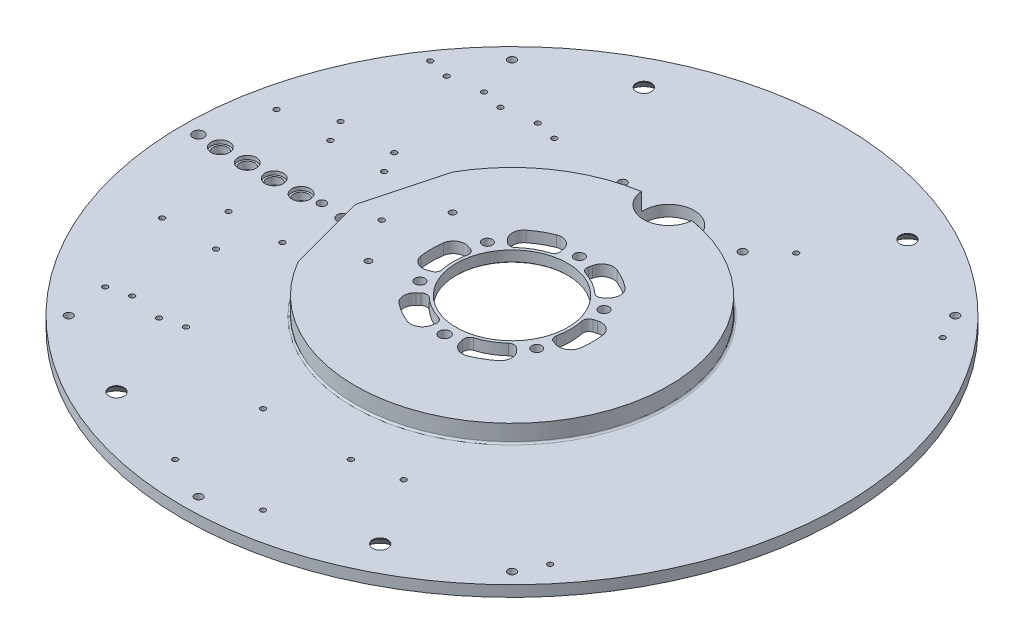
SolidWorks part; units mm, degrees
ref_plane "Front Plane" through (0, 0, 0) normal (0, 0, 1) x (1, 0, 0)
ref_plane "Top Plane" through (0, 0, 0) normal (0, 1, 0) x (1, 0, 0)
ref_plane "Right Plane" through (0, 0, 0) normal (1, 0, 0) x (0, 0, -1)
sketch "Sketch1" plane through (0, 0, 0) normal (0, 0, 1) x (1, 0, 0)
  line L0 (0, 0) -> (0, 40.0271) construction
  line L1 (-67.945, 0) -> (-142.875, 0)
  line L2 (-142.875, 0) -> (-142.875, -4.7625)
  line L3 (-61.9125, -4.7625) -> (-142.875, -4.7625)
  line L4 (-24.13, 7.62) -> (-24.13, 2.8575)
  line L5 (-67.945, 0) -> (-67.945, 7.62)
  line L6 (-67.945, 7.62) -> (-24.13, 7.62)
  line L7 (-61.9125, -4.7625) -> (-61.9125, 2.8575)
  line L8 (-61.9125, 2.8575) -> (-24.13, 2.8575)
  dimension "D1" = 285.75
  dimension "D2" = 4.7625
  dimension "D3" = 48.26
  dimension "D4" = 4.7625
  dimension "D5" = 135.89
  dimension "D6" = 123.825
  dimension "D7" = 7.62
  dimension "D8" = 12.3825
revolve "Revolve1" add sketch "Sketch1" angle 360 about L0
hole_wizard "#8-32 Tapped Hole1" positions "Sketch8" profile "Sketch7" tap size "#8-32" standard "ANSI Inch"
sketch "Sketch8" plane through (0, 0, 0) normal (0, 1, 0) x (1, 0, 0)
  line L0 (0, -135.89) -> (0, 0) construction
  point P0 (0, -135.89)
  dimension "D1" = 135.89
sketch "Sketch7" plane through (0, 0, 135.89) normal (1, 0, 0) x (0, 0, 1)
  line L0 (0, 0) -> (0, 12.446)
  line L1 (0, 12.446) -> (1.7272, 12.446)
  line L2 (1.7272, 12.446) -> (1.7272, 0)
  line L5 (1.7272, 0) -> (0, 0)
  line L10 (0, 12.446) -> (-1.7272, 12.446) construction
  line L11 (0, -6.35) -> (0, 107.95) construction
  dimension "Tap Drill Dia." = 3.4544
  dimension "Tap Drill Depth" = 12.446
  dimension "Drill Angle" = 180
pattern_circular "CirPattern1" count 8 over 360 about axis through (0, 0, 0) along (0, 1, 0) of "#8-32 Tapped Hole1"
hole_wizard "#8 Clearance Hole1" positions "Sketch10" profile "Sketch9" hole size "#8" standard "ANSI Inch"
sketch "Sketch10" plane through (0, 7.62, 0) normal (0, 1, 0) x (1, 0, 0)
  line L1 (0, 0) -> (-25.2966, 14.605) construction
  circle A0 centre (-25.2966, 14.605) radius 2.0828 construction
  point P4 (-25.2966, 14.605)
sketch "Sketch9" plane through (-25.2966, 7.62, -14.605) normal (1, 0, 0) x (0, 0, 1)
  line L0 (0, 0) -> (0, 12.3825)
  line L1 (0, 12.3825) -> (2.1526, 12.3825)
  line L2 (2.1526, 12.3825) -> (2.1526, 0)
  line L5 (2.1526, 0) -> (0, 0)
  line L11 (0, -6.35) -> (0, 107.95) construction
  dimension "Thru Hole Dia." = 4.3053
  dimension "Thru Hole Depth" = 12.3825
pattern_circular "CirPattern2" count 6 over 360 about axis through (0, 0, 0) along (0, 1, 0) of "#8 Clearance Hole1"
sketch "Sketch11" plane through (0, 2.8575, 0) normal (0, 1, 0) x (1, 0, 0)
  line L0 (0, 0) -> (-18.876, -20.5995) construction
  line L1 (-13.6339, 0) -> (0, 0) construction
  line L2 (0, 0) -> (-8.4017, -26.6469) construction
  line L3 (0, 0) -> (-25.2966, -14.605) construction
  line L4 (0, -29.21) -> (-12.7, -21.997) construction
  line L5 (-12.7, -21.997) -> (0, 0) construction
  line L6 (-12.7, -21.997) -> (-25.2966, -14.605) construction
  line L7 (0, -29.21) -> (0, 0) construction
  line L8 (-20.6687, -18.8002) -> (-21.7558, -19.789)
  line L9 (-5.9471, -27.2997) -> (-6.2598, -28.7356)
  line L10 (0, 0) -> (-93.5226, -421.8534) construction
  line L11 (0, 0) -> (-318.5744, -291.9197) construction
  arc A0 (-5.9471, -27.2997) -> (-7.6379, -24.2244) centre (-8.4017, -26.6469) ccw
  circle A1 centre (0, 0) radius 27.94 construction
  arc A2 (-17.16, -18.7268) -> (-7.6379, -24.2244) centre (0, 0) ccw
  arc A3 (-21.4589, -27.5549) -> (-13.1338, -32.3614) centre (0, 0) ccw
  arc A4 (-17.16, -18.7268) -> (-20.6687, -18.8002) centre (-18.876, -20.5995) ccw
  arc A5 (-21.4589, -27.5549) -> (-21.7558, -19.789) centre (-18.3376, -23.5469) cw
  arc A6 (-13.1338, -32.3614) -> (-6.2598, -28.7356) centre (-11.2234, -27.6543) ccw
  circle A7 centre (-93.5226, -421.8534) radius 1.5875 construction
  circle A8 centre (-318.5744, -291.9197) radius 1.5875 construction
  dimension "D3" = 34.925
  dimension "D4" = 2.54
  dimension "D2" = 25.4
  dimension "D5" = 5.08
  dimension "D6" = 3.175
  dimension "D1" = 25
extrude "Cut-Extrude2" cut sketch "Sketch11" along normal through all
pattern_circular "CirPattern3" count 6 over 360 about axis through (0, 0, 0) along (0, 1, 0) of "Cut-Extrude2"
sketch "Sketch31" plane through (0, 7.62, 0) normal (0, 1, 0) x (1, 0, 0)
  line L0 (0, -29.21) -> (0, 0) construction
  line L1 (0, 0) -> (-25.2966, -14.605) construction
  circle A0 centre (0, -29.21) radius 2.3813
  dimension "D1" = 4.7625
extrude "Cut-Extrude8" cut sketch "Sketch31" against normal through all
hole_wizard "#4-40 Tapped Hole1" positions "Sketch13" profile "Sketch12" tap size "#4-40" standard "ANSI Inch"
sketch "Sketch13" plane through (0, 0, 0) normal (0, 1, 0) x (1, 0, 0)
  line L2 (-100.5717, -22.3329) -> (-77.2384, -22.3329) construction
  line L4 (-112.4873, -39.1996) -> (-89.154, -39.1996) construction
  line L7 (-89.7674, -74.9225) -> (-66.4341, -74.9225) construction
  line L10 (-98.9678, -77.3878) -> (-75.6345, -77.3878) construction
  line L14 (-104.0641, 75.7496) -> (-80.7307, 75.7496) construction
  line L15 (-80.7307, 75.7496) -> (-57.3974, 75.7496) construction
  line L17 (-113.3449, 77.8922) -> (-90.0116, 77.8922) construction
  line L18 (-90.0116, 77.8922) -> (-66.6783, 77.8922) construction
  line L20 (-110.0553, 35.6844) -> (-86.722, 35.6844) construction
  line L21 (-86.722, 35.6844) -> (-63.3886, 35.6844) construction
  line L23 (-81.8279, 26.3861) -> (-105.1613, 26.3861) construction
  line L24 (-105.1613, 26.3861) -> (-128.4946, 26.3861) construction
  circle A32 centre (-113.3449, 77.8922) radius 1.7272 construction
  circle A33 centre (-104.0641, 75.7496) radius 1.7272 construction
  circle A34 centre (-90.0116, 77.8922) radius 1.7272 construction
  circle A35 centre (-80.7307, 75.7496) radius 1.7272 construction
  circle A36 centre (-128.4946, 26.3861) radius 1.4732 construction
  circle A37 centre (-110.0553, 35.6844) radius 1.4732 construction
  circle A38 centre (-105.1613, 26.3861) radius 1.4732 construction
  circle A39 centre (-86.722, 35.6844) radius 1.4732 construction
  circle A40 centre (-112.4873, -39.1996) radius 1.4732 construction
  circle A41 centre (-100.5717, -22.3329) radius 1.4732 construction
  circle A42 centre (-77.2384, -22.3329) radius 1.4732 construction
  circle A43 centre (-89.154, -39.1996) radius 1.4732 construction
  circle A47 centre (-98.9678, -77.3878) radius 1.7272 construction
  circle A48 centre (-89.7674, -74.9225) radius 1.7272 construction
  circle A49 centre (-75.6345, -77.3878) radius 1.7272 construction
  circle A51 centre (-66.4341, -74.9225) radius 1.7272 construction
  point P0 (-98.9678, -77.3878)
  point P2 (-89.7674, -74.9225)
  point P4 (-112.4873, -39.1996)
  point P6 (-100.5717, -22.3329)
  point P8 (-75.6345, -77.3878)
  point P10 (-66.4341, -74.9225)
  point P12 (-89.154, -39.1996)
  point P14 (-77.2384, -22.3329)
  point P16 (-128.4946, 26.3861)
  point P18 (-110.0553, 35.6844)
  point P20 (-104.0641, 75.7496)
  point P22 (-113.3449, 77.8922)
  point P24 (-105.1613, 26.3861)
  point P26 (-86.722, 35.6844)
  point P28 (-80.7307, 75.7496)
  point P30 (-90.0116, 77.8922)
  point P68 (-66.6783, 77.8922)
  point P70 (-57.3974, 75.7496)
  point P72 (-81.8279, 26.3861)
  point P74 (-63.3886, 35.6844)
sketch "Sketch12" plane through (-98.9678, 0, 77.3878) normal (1, 0, 0) x (0, 0, 1)
  line L0 (0, 0) -> (0, 4.7625)
  line L1 (0, 4.7625) -> (1.1303, 4.7625)
  line L2 (1.1303, 4.7625) -> (1.1303, 0)
  line L5 (1.1303, 0) -> (0, 0)
  line L11 (0, -6.35) -> (0, 107.95) construction
  dimension "Thru Tap Drill Dia." = 2.2606
  dimension "Thru Tap Drill Depth" = 4.7625
hole_wizard "#4-40 Tapped Hole2" positions "Sketch15" profile "Sketch14" tap size "#4-40" standard "ANSI Inch"
sketch "Sketch15" plane through (0, 0, 0) normal (0, 1, 0) x (1, 0, 0)
  line L0 (38.1, 85.09) -> (101.6, 85.09) construction
  line L1 (101.6, 85.09) -> (101.6, -85.09) construction
  line L2 (101.6, -85.09) -> (38.1, -85.09) construction
  line L3 (38.1, -85.09) -> (38.1, 85.09) construction
  line L5 (0, 0) -> (38.1, 0) construction
  line L6 (38.1, 0) -> (101.6, 0) construction
  line L8 (19.05, -50.8) -> (19.05, -88.9) construction
  line L9 (19.05, -88.9) -> (19.05, -127) construction
  line L10 (19.05, -127) -> (-19.05, -127) construction
  line L11 (-19.05, -127) -> (-19.05, -88.9) construction
  line L12 (-19.05, -88.9) -> (-19.05, -50.8) construction
  line L13 (-19.05, -50.8) -> (19.05, -50.8) construction
  line L15 (-19.05, -88.9) -> (19.05, -88.9) construction
  line L17 (0, -50.8) -> (0, 0) construction
  point P0 (101.6, -85.09)
  point P2 (101.6, 85.09)
  point P4 (38.1, 85.09)
  point P6 (38.1, -85.09)
  point P26 (19.05, -50.8)
  point P28 (-19.05, -50.8)
  point P30 (-19.05, -88.9)
  point P32 (19.05, -88.9)
  point P34 (19.05, -127)
  point P36 (-19.05, -127)
  dimension "D1" = 170.18
  dimension "D2" = 63.5
  dimension "D3" = 101.6
  dimension "D4" = 38.1
  dimension "D5" = 88.9
sketch "Sketch14" plane through (101.6, 0, 85.09) normal (1, 0, 0) x (0, 0, 1)
  line L0 (0, 0) -> (0, 4.7625)
  line L1 (0, 4.7625) -> (1.1303, 4.7625)
  line L2 (1.1303, 4.7625) -> (1.1303, 0)
  line L5 (1.1303, 0) -> (0, 0)
  line L11 (0, -6.35) -> (0, 107.95) construction
  dimension "Thru Tap Drill Dia." = 2.2606
  dimension "Thru Tap Drill Depth" = 4.7625
hole_wizard "CSK for #6 Flat Head Machine Screw2" positions "Sketch17" profile "Sketch16" countersink size "#6" standard "ANSI Inch"
sketch "Sketch17" plane through (0, 0, 0) normal (0, 1, 0) x (1, 0, 0)
  line L0 (-135.901, 9.525) -> (-135.901, -9.525) construction
  line L2 (-135.901, 0) -> (-63.511, 0) construction
  line L3 (-63.511, 0) -> (0, 0) construction
  line L5 (-62.241, 9.525) -> (-62.241, -9.525) construction
  point P12 (-62.241, 9.525)
  point P14 (-135.901, -9.525)
  point P16 (-135.901, 9.525)
  point P40 (-62.241, -9.525)
sketch "Sketch16" plane through (-62.241, 0, -9.525) normal (1, 0, 0) x (0, 0, 1)
  line L0 (0, 0) -> (0, 4.7625)
  line L1 (0, 4.7625) -> (1.8288, 4.7625)
  line L2 (1.8288, 4.7625) -> (1.8288, 1.9723)
  line L3 (1.8288, 1.9723) -> (3.5433, 0)
  line L5 (3.5433, 0) -> (0, 0)
  line L6 (-1.8288, 1.9723) -> (-3.5433, 0) construction
  line L11 (0, -6.35) -> (0, 107.95) construction
  dimension "Thru Hole Dia." = 3.6576
  dimension "Thru Hole Depth" = 4.7625
  dimension "Near C'Sink Dia." = 7.0866
  dimension "Near C'Sink Angle" = 82
sketch "Sketch5" plane through (0, 0, 0) normal (0, 1, 0) x (1, 0, 0)
  line L0 (-73.441, -3.81) -> (-135.941, -3.81)
  line L1 (-73.441, 3.81) -> (-135.941, 3.81)
  line L2 (-135.941, 0) -> (-73.441, 0) construction
  line L3 (-112.4873, -39.1996) -> (-100.5717, -22.3329) construction
  line L4 (-98.9678, -77.3878) -> (-89.7674, -74.9225) construction
  line L5 (-94.3676, -76.1551) -> (-106.5295, -30.7663) construction
  line L6 (-106.5295, -30.7663) -> (-135.941, 0) construction
  line L7 (-63.3886, 35.6844) -> (-81.8279, 26.3861) construction
  line L8 (-57.3974, 75.7496) -> (-66.6783, 77.8922) construction
  line L9 (-62.0378, 76.8209) -> (-72.6083, 31.0352) construction
  line L10 (-74.6487, 30.0063) -> (-73.441, 0) construction
  arc A0 (-73.441, -3.81) -> (-73.441, 3.81) centre (-73.441, 0) ccw
  arc A1 (-135.941, 3.81) -> (-135.941, -3.81) centre (-135.941, 0) ccw
  circle A2 centre (-73.441, 0) radius 2.3812 construction
  circle A3 centre (-135.941, 0) radius 2.3813 construction
  dimension "D1" = 7.62
extrude "Cut-Extrude1" [suppressed] cut sketch "Sketch5" against normal through all
hole_wizard "CSK for 1/4 Flat Head Machine Screw1" positions "Sketch19" profile "Sketch18" countersink size "1/4" standard "ANSI Inch"
sketch "Sketch19" plane through (0, -4.7625, 0) normal (0, -1, 0) x (-1, 0, 0)
  line L0 (57.15, 114.3) -> (-57.15, 114.3) construction
  line L1 (-57.15, 114.3) -> (-57.15, -114.3) construction
  line L2 (-57.15, -114.3) -> (57.15, -114.3) construction
  line L3 (57.15, -114.3) -> (57.15, 114.3) construction
  line L5 (57.15, 0) -> (0, 0) construction
  line L6 (0, 0) -> (0, 114.3) construction
  point P0 (57.15, -114.3)
  point P2 (-57.15, -114.3)
  point P4 (-57.15, 114.3)
  point P6 (57.15, 114.3)
  dimension "D1" = 114.3
  dimension "D2" = 228.6
sketch "Sketch18" plane through (-57.15, -4.7625, 114.3) normal (1, 0, 0) x (0, 0, -1)
  line L0 (0, 0) -> (0, 12.3825)
  line L1 (0, 12.3825) -> (3.2639, 12.3825)
  line L2 (3.2639, 12.3825) -> (3.2639, 4.4144)
  line L3 (3.2639, 4.4144) -> (7.1013, 0)
  line L5 (7.1013, 0) -> (0, 0)
  line L6 (-3.2639, 4.4144) -> (-7.1013, 0) construction
  line L11 (0, -6.35) -> (0, 107.95) construction
  dimension "Thru Hole Dia." = 6.5278
  dimension "Thru Hole Depth" = 12.3825
  dimension "Near C'Sink Dia." = 14.2026
  dimension "Near C'Sink Angle" = 82
sketch "Sketch20" plane through (0, -4.7625, 0) normal (0, -1, 0) x (1, 0, 0)
  circle A0 centre (0, 0) radius 139.7
  dimension "D1" = 279.4
extrude "Cut-Extrude3" [suppressed] cut sketch "Sketch20" against normal blind 0.127 flip side to cut
sketch "Sketch21" plane through (0, 0, 0) normal (0, 1, 0) x (1, 0, 0)
  line L0 (-66.6783, 77.8922) -> (-57.3974, 75.7496) construction
  line L1 (-63.3886, 35.6844) -> (-81.8279, 26.3861) construction
  line L2 (-62.0378, 76.8209) -> (-72.6083, 31.0352) construction
  line L3 (0, 0) -> (-165.1234, 0) construction
  line L4 (-66.4341, -74.9225) -> (-75.6345, -77.3878) construction
  line L5 (-77.2384, -22.3329) -> (-89.154, -39.1996) construction
  line L6 (-100.5717, -22.3329) -> (-112.4873, -39.1996) construction
  line L7 (-89.7674, -74.9225) -> (-98.9678, -77.3878) construction
  line L8 (-71.0343, -76.1551) -> (-83.1962, -30.7663) construction
  line L9 (-94.3676, -76.1551) -> (-106.5295, -30.7663) construction
  line L10 (-90.0116, 77.8922) -> (-80.7307, 75.7496) construction
  line L11 (-85.3712, 76.8209) -> (-95.9416, 31.0352) construction
  line L12 (-86.722, 35.6844) -> (-105.1613, 26.3861) construction
  line L13 (-119.2749, 31.0352) -> (-108.7045, 76.8209) construction
  line L14 (-110.0553, 35.6844) -> (-128.4946, 26.3861) construction
  line L15 (-95.9416, 31.0352) -> (-103.1067, 0) construction
  line L16 (-113.3449, 77.8922) -> (-104.0641, 75.7496) construction
  line L17 (-119.2749, 31.0352) -> (-126.44, 0) construction
  line L18 (-106.5295, -30.7663) -> (-114.7733, 0) construction
  line L19 (-83.1962, -30.7663) -> (-91.44, 0) construction
  dimension "D1" = 114.7733
  dimension "D2" = 126.44
  dimension "D3" = 91.44
  dimension "D4" = 103.1067
sketch "Sketch22" plane through (0, 0, 0) normal (0, 1, 0) x (1, 0, 0)
  line L0 (0, 0) -> (-165.1234, 0) construction
  line L1 (-103.1067, 0) -> (-114.7733, 0) construction
  line L2 (-103.1067, 0) -> (-91.44, 0) construction
  line L3 (-114.7733, 0) -> (-126.44, 0) construction
  line L4 (-91.44, 0) -> (-79.7733, 0) construction
  line L5 (-83.44, 1) -> (-79.7733, 0) construction
  line L6 (-63.3886, 35.6844) -> (-81.8279, 26.3861) construction
  line L7 (-72.6083, 31.0352) -> (-79.7733, 0) construction
  circle A0 centre (-126.44, 0) radius 3.175
  circle A1 centre (-114.7733, 0) radius 3.175
  circle A2 centre (-91.44, 0) radius 3.175
  circle A3 centre (-103.1067, 0) radius 3.175
  circle A4 centre (-135.94, 0) radius 2.3813
  circle A5 centre (-73.44, 0) radius 2.3813
  circle A6 centre (-83.44, 1) radius 1.7856
  point P2 (-79.7733, 0)
  dimension "D1" = 6.35
  dimension "D2" = 4.7625
  dimension "D3" = 91.44
  dimension "D4" = 35
  dimension "D5" = 1
  dimension "D6" = 18
  dimension "D7" = 3.5712
  dimension "D8" = 8
  dimension "D9" = 62.5
  dimension "D10" = 87.745
  dimension "```" = 52.5
extrude "Cut-Extrude4" cut sketch "Sketch22" against normal through all
sketch "Sketch23" plane through (0, 0, 0) normal (0, 1, 0) x (1, 0, 0)
  circle A0 centre (-73.44, 0) radius 3.9687
  circle A1 centre (-135.94, 0) radius 3.9687
  dimension "D1" = 7.9375
extrude "Cut-Extrude5" [suppressed] cut sketch "Sketch23" against normal blind 3.175
sketch "Sketch24" plane through (0, 0, 0) normal (0, 1, 0) x (1, 0, 0)
  line L0 (-91.44, 0) -> (-114.7733, 0) construction
  line L2 (-91.44, 0) -> (-68.1067, 0) construction
  line L3 (0, 0) -> (-165.1234, 0) construction
  line L4 (-68.1067, 0) -> (-44.8522, 86.7868)
  line L5 (-68.1067, 0) -> (-44.8522, -86.7868)
  arc A0 (-44.8522, 86.7868) -> (-44.8522, -86.7868) centre (0, 0) ccw
  circle A1 centre (-91.44, 0) radius 3.175 construction
  dimension "D1" = 75
extrude "Cut-Extrude6" cut sketch "Sketch24" along normal through all
sketch "Sketch26" plane through (0, -4.7625, 0) normal (0, -1, 0) x (1, 0, 0)
  line L0 (0, -68) -> (0, 0) construction
  circle A0 centre (0, -68) radius 11
  dimension "D1" = 22
  dimension "D2" = 68
extrude "Cut-Extrude7" cut sketch "Sketch26" against normal through all
chamfer "Chamfer2" distance 0.254 angle 45 1 edges at (0, 2.8575, -24.13)
hole_wizard "#6-32 Tapped Hole1" positions "Sketch33" profile "Sketch32" tap size "#6-32" standard "ANSI Inch"
sketch "Sketch33" plane through (0, 7.62, 0) normal (0, 1, 0) x (1, 0, 0)
  line L0 (-43.9998, 18.2253) -> (0, 0) construction
  line L1 (0, 0) -> (-43.9998, -18.2253) construction
  line L2 (-43.9998, -18.2253) -> (-43.9998, 18.2253) construction
  line L4 (-43.9998, 0) -> (0, 0) construction
  point P0 (-43.9998, -18.2253)
  point P2 (-43.9998, 18.2253)
  dimension "D1" = 47.625
  dimension "D2" = 45
sketch "Sketch32" plane through (-43.9998, 7.62, 18.2253) normal (1, 0, 0) x (0, 0, 1)
  line L0 (0, 0) -> (0, 12.3825)
  line L1 (0, 12.3825) -> (1.3525, 12.3825)
  line L2 (1.3525, 12.3825) -> (1.3525, 0)
  line L5 (1.3525, 0) -> (0, 0)
  line L11 (0, -6.35) -> (0, 107.95) construction
  dimension "Thru Tap Drill Dia." = 2.7051
  dimension "Thru Tap Drill Depth" = 12.3825
hole_wizard "#8-32 Tapped Hole2" positions "Sketch35" profile "Sketch34" tap size "#8-32" standard "ANSI Inch"
sketch "Sketch35" plane through (0, 0, 0) normal (0, 1, 0) x (1, 0, 0)
  line L0 (26, 74) -> (0, 74) construction
  line L2 (0, 74) -> (-26, 74) construction
  line L3 (0, 68) -> (0, 74) construction
  point P0 (26, 74)
  point P2 (-26, 74)
  dimension "D1" = 26
  dimension "D2" = 6
sketch "Sketch34" plane through (26, 0, -74) normal (1, 0, 0) x (0, 0, 1)
  line L0 (0, 0) -> (0, 4.7625)
  line L1 (0, 4.7625) -> (1.7272, 4.7625)
  line L2 (1.7272, 4.7625) -> (1.7272, 0)
  line L5 (1.7272, 0) -> (0, 0)
  line L11 (0, -6.35) -> (0, 107.95) construction
  dimension "Thru Tap Drill Dia." = 3.4544
  dimension "Thru Tap Drill Depth" = 4.7625
fillet "Fillet1" radius 0.762 6 edges at (-63.5444, 0, 17.0267) (-67.945, 0, 0) (-63.5444, 0, -17.0267) (-38.8743, 0, -55.7253) (55.7253, 0, 38.8743) (0, 2.8575, 61.9125)
chamfer "Chamfer3" distance 1.016 angle 45 1 edges at (0, -4.7625, 61.9125)
sketch "Sketch36" plane through (0, 0, 0) normal (0, 1, 0) x (1, 0, 0)
  circle A0 centre (-91.44, 0) radius 3.9687
  circle A1 centre (-103.1067, 0) radius 3.9688
  circle A2 centre (-114.7733, 0) radius 3.9688
  circle A3 centre (-126.44, 0) radius 3.9687
  dimension "D1" = 7.9375
extrude "Cut-Extrude9" cut sketch "Sketch36" against normal blind 1.5875
sketch "Sketch37" plane through (0, 7.62, 0) normal (0, 1, 0) x (1, 0, 0)
  line L0 (-56.515, 0) -> (0, 0) construction
  circle A0 centre (-56.515, 0) radius 1.1906
  dimension "D2" = 2.3813
  dimension "D1" = 56.515
extrude "Cut-Extrude10" cut sketch "Sketch37" against normal blind 10
